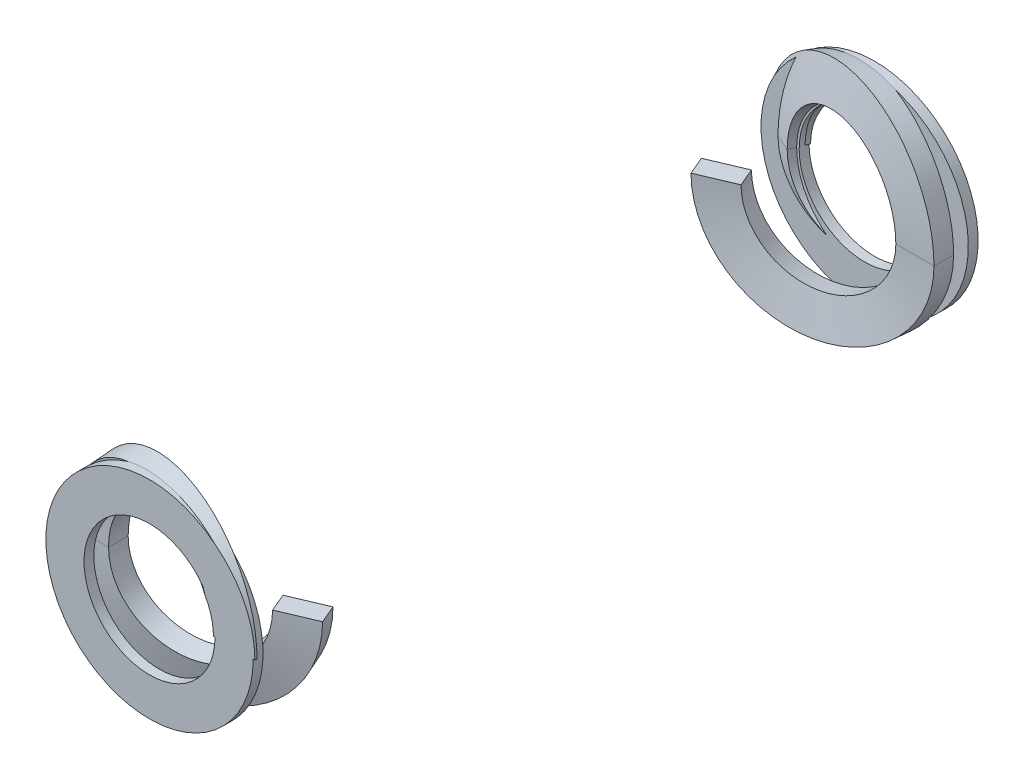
SolidWorks part; units mm, degrees
ref_plane "Front" through (0, 0, 0) normal (0, 0, 1) x (1, 0, 0)
ref_plane "Top" through (0, 0, 0) normal (0, 1, 0) x (1, 0, 0)
ref_plane "Right" through (0, 0, 0) normal (1, 0, 0) x (0, 0, -1)
sketch "Logo3_Revol_Axis" plane through (0, 0, 0) normal (0, 1, 0) x (1, 0, 0)
  line L0 (0, -30.1034) -> (0, 30.1034) construction
sketch "Logo3_bib0" plane through (0, 0, 0) normal (0, 1, 0) x (1, 0, 0)
  line L0 (-6.35, 0) -> (6.35, 0) construction
  line L1 (0, 0) -> (0, 41.91) construction
  dimension "logo3_d1" = 12.7
  dimension "logo3_l1" = 41.91
sketch "logo3_bib1" plane through (0, 0, 0) normal (0, 1, 0) x (1, 0, 0)
  line L0 (-6.35, 0) -> (6.35, 0) construction
  line L1 (6.35, 0) -> (6.35, 41.91) construction
  line L2 (6.35, 41.91) -> (-6.35, 41.91) construction
  line L3 (-6.35, 41.91) -> (-6.35, 0) construction
  line L4 (5.9927, 0) -> (5.9927, 41.91) construction
  line L5 (-5.9927, 42.4772) -> (-5.9927, 0) construction
  line L6 (3.7869, 0) -> (3.7869, 41.91) construction
  line L7 (-3.7869, 0) -> (-3.7869, 42.4772) construction
  line L8 (0, 0) -> (0, 41.91) construction
  line L9 (4.8898, 41.91) -> (4.8898, 0) construction
  line L10 (-4.8898, 41.91) -> (-4.8898, 0) construction
  line L11 (4.8898, 0) -> (-4.8898, 1.9853) construction
  line L12 (0, 0.9926) -> (0.5968, 3.9327) construction
  line L13 (-4.8898, 1.9853) -> (4.8898, 3.9706) construction
  line L14 (-4.8898, 41.91) -> (4.8898, 39.9247) construction
  line L15 (4.8898, 3.9706) -> (-4.8898, 5.9559) construction
  line L16 (0, 2.9779) -> (-0.5968, 5.918) construction
  line L17 (0, 4.9632) -> (0.5968, 7.9033) construction
  line L18 (0, 40.9174) -> (-0.5968, 37.9773) construction
  line L19 (-22.523, 45.8806) -> (29.4917, 45.8806) construction
  line L20 (-22.523, -7.9412) -> (25.6601, -7.9412) construction
  line L21 (4.8898, 39.9247) -> (-4.8898, 37.9394) construction
  line L22 (0, 38.9321) -> (0.5968, 35.992) construction
  line L23 (0, 0) -> (-0.5968, 2.94) construction
  line L24 (-5.9927, 42.4772) -> (-3.7869, 42.4772)
  line L25 (-5.9927, 42.4772) -> (-5.9927, 41.3428)
  line L26 (-5.9927, 41.3428) -> (-3.7869, 41.3428)
  line L27 (-3.7869, 42.4772) -> (-3.7869, 41.3428)
  line L28 (3.7869, -0.5672) -> (5.9927, -0.5672)
  line L29 (3.7869, -0.5672) -> (3.7869, 0.5672)
  line L30 (3.7869, 0.5672) -> (5.9927, 0.5672)
  line L31 (5.9927, -0.5672) -> (5.9927, 0.5672)
  line L32 (0, 41.91) -> (0.5968, 38.97) construction
  circle A1 centre (4.8898, 39.9247) radius 1.1029
  circle A2 centre (4.8898, 3.9706) radius 1.1029
  circle A4 centre (-4.8898, 1.9853) radius 1.1029
  circle A5 centre (-4.8898, 5.9559) radius 1.1029
  circle A6 centre (-4.8898, 37.9394) radius 1.1029
sketch "Sketch4" plane through (0, 0, 0) normal (0, 1, 0) x (1, 0, 0)
  line L0 (0, 0) -> (0, 41.91) construction
  line L1 (0, 0) -> (0, 41.91) construction
  line L2 (-5.9927, 42.4772) -> (-5.9927, 41.3428) construction
  line L3 (-5.9927, 41.3428) -> (-3.7869, 41.3428) construction
  line L4 (-3.7869, 42.4772) -> (-3.7869, 41.3428) construction
  line L5 (-5.9927, 42.4772) -> (-3.7869, 42.4772) construction
  line L6 (-5.9927, 42.4772) -> (-5.9927, 41.3428)
  line L7 (-5.9927, 41.3428) -> (-3.7869, 41.3428)
  line L8 (-3.7869, 42.4772) -> (-3.7869, 41.3428)
  line L9 (-5.9927, 42.4772) -> (-3.7869, 42.4772)
  line L10 (3.7869, -0.5672) -> (3.7869, 0.5672) construction
  line L11 (3.7869, 0.5672) -> (5.9927, 0.5672) construction
  line L12 (5.9927, -0.5672) -> (5.9927, 0.5672) construction
  line L13 (3.7869, -0.5672) -> (5.9927, -0.5672) construction
  line L14 (3.7869, -0.5672) -> (3.7869, 0.5672)
  line L15 (3.7869, 0.5672) -> (5.9927, 0.5672)
  line L16 (5.9927, -0.5672) -> (5.9927, 0.5672)
  line L17 (3.7869, -0.5672) -> (5.9927, -0.5672)
revolve "Revolve2" add sketch "Sketch4" angle 360 about L1
sketch "Sketch5" plane through (0, 0, 0) normal (0, -1, 0) x (1, 0, 0)
  line L0 (0, -0.9926) -> (0.5968, -3.9327) construction
  line L1 (0, -0.9926) -> (0.5968, -3.9327) construction
  line L2 (-5.9927, -42.4772) -> (-5.9927, 0) construction
  line L3 (-3.7869, 0) -> (-3.7869, -42.4772) construction
  line L7 (-5.9927, -1.4181) -> (-3.7869, -1.4181)
  line L8 (-5.9927, -1.4181) -> (-5.9927, -2.5525)
  line L9 (-5.9927, -2.5525) -> (-3.7869, -2.5525)
  line L10 (-3.7869, -1.4181) -> (-3.7869, -2.5525)
revolve "Revolve3" add sketch "Sketch5" angle 180 about L1
sketch "Sketch6" plane through (0, 0, 0) normal (0, 1, 0) x (1, 0, 0)
  line L0 (0, 2.9779) -> (-0.5968, 5.918) construction
  line L1 (0, 2.9779) -> (-0.5968, 5.918) construction
  line L6 (-3.7869, 2.5525) -> (-3.7869, 1.4181) construction
  line L7 (-5.9927, 2.5525) -> (-3.7869, 2.5525) construction
  line L8 (-5.9927, 1.4181) -> (-5.9927, 2.5525) construction
  line L9 (-3.7869, 1.4181) -> (-5.9927, 1.4181) construction
  line L10 (-3.7869, 2.5525) -> (-3.7869, 1.4181)
  line L11 (-5.9927, 2.5525) -> (-3.7869, 2.5525)
  line L12 (-5.9927, 1.4181) -> (-5.9927, 2.5525)
  line L13 (-3.7869, 1.4181) -> (-5.9927, 1.4181)
revolve "Revolve4" add sketch "Sketch6" angle 180 about L1
sketch "Sketch11" plane through (0, 0, 0) normal (0, 1, 0) x (1, 0, 0)
  line L0 (3.653, -0.0922) -> (5.6843, -0.9524) construction
  line L1 (4.7747, -0.5672) -> (5.6843, -0.9524)
  line L3 (5.6843, -0.9524) -> (6.1266, 0.0922) construction
  line L4 (0, 0) -> (-0.5968, 2.94) construction
  line L5 (0, 0) -> (-0.5968, 2.94) construction
  line L7 (5.6843, -0.9524) -> (5.8474, -0.5672)
  line L8 (3.7869, -0.5672) -> (5.9927, -0.5672) construction
  line L10 (4.7747, -0.5672) -> (5.8474, -0.5672)
revolve "Revolve8" add sketch "Sketch11" angle 90 about L5
sketch "Sketch8" plane through (0, 0, 0) normal (0, 1, 0) x (1, 0, 0)
  line L0 (0, 40.9174) -> (-0.5968, 37.9773) construction
  line L1 (0, 40.9174) -> (-0.5968, 37.9773) construction
  line L2 (5.9927, 0) -> (5.9927, 41.91) construction
  line L3 (3.7869, 0) -> (3.7869, 41.91) construction
  line L11 (5.9927, 40.4919) -> (3.7869, 40.4919)
  line L12 (5.9927, 40.4919) -> (5.9927, 39.3575)
  line L13 (5.9927, 39.3575) -> (3.7869, 39.3575)
  line L14 (3.7869, 40.4919) -> (3.7869, 39.3575)
revolve "Revolve6" add sketch "Sketch8" angle 180 about L1
sketch "Sketch10" plane through (0, 0, 0) normal (0, 1, 0) x (1, 0, 0)
  line L0 (0, 38.9321) -> (0.5968, 35.992) construction
  line L1 (0, 38.9321) -> (0.5968, 35.992) construction
  line L11 (5.9927, 39.3575) -> (5.9927, 40.4919)
  line L12 (3.7869, 39.3575) -> (5.9927, 39.3575)
  line L13 (3.7869, 40.4919) -> (3.7869, 39.3575)
  line L14 (5.9927, 40.4919) -> (3.7869, 40.4919)
  line L15 (5.9927, 39.3575) -> (5.9927, 40.4919)
  line L16 (3.7869, 39.3575) -> (5.9927, 39.3575)
  line L17 (3.7869, 40.4919) -> (3.7869, 39.3575)
  line L18 (5.9927, 40.4919) -> (3.7869, 40.4919)
  dimension "D1" = 0
revolve "Revolve7" add sketch "Sketch10" angle 180 about L1
sketch "Sketch13" plane through (0, 0, 0) normal (0, 1, 0) x (1, 0, 0)
  line L0 (-3.653, 42.0022) -> (-4.0954, 40.9576) construction
  line L1 (-4.0954, 40.9576) -> (-6.1266, 41.8178) construction
  line L2 (-3.9322, 41.3428) -> (-4.0954, 40.9576)
  line L3 (-4.0954, 40.9576) -> (-5.005, 41.3428)
  line L4 (-5.9927, 41.3428) -> (-3.7869, 41.3428) construction
  line L5 (-5.005, 41.3428) -> (-3.9322, 41.3428)
  line L6 (0, 41.91) -> (0.5968, 38.97) construction
  line L7 (0, 41.91) -> (0.5968, 38.97) construction
revolve "Revolve9" add sketch "Sketch13" angle 90 about L7
sketch "Sketch9" plane through (0, 0, 0) normal (0, 1, 0) x (1, 0, 0)
  line L0 (6.35, 0) -> (6.35, 41.91) construction
  line L1 (-6.35, 0) -> (6.35, 0)
  line L2 (-6.35, 0) -> (-6.35, -7.9412)
  line L3 (-6.35, -7.9412) -> (6.35, -7.9412)
  line L4 (6.35, 0) -> (6.35, -7.9412)
  line L5 (-6.35, 41.91) -> (-6.35, 0) construction
  line L6 (6.35, 41.91) -> (-6.35, 41.91)
  line L7 (6.35, 41.91) -> (6.35, 45.8806)
  line L8 (6.35, 45.8806) -> (-6.35, 45.8806)
  line L9 (-6.35, 41.91) -> (-6.35, 45.8806)
  line L10 (-22.523, -7.9412) -> (25.6601, -7.9412) construction
  line L11 (-22.523, 45.8806) -> (29.4917, 45.8806) construction
extrude "Cut-Extrude1" cut sketch "Sketch9" against normal through all and the other way through all
sketch "Sketch14" plane through (0, 0, 0) normal (0, 1, 0) x (1, 0, 0)
  line L0 (4.8898, 41.91) -> (4.8898, 0) construction
  line L1 (-4.8898, 41.91) -> (-4.8898, 0) construction
  line L2 (4.8898, 41.91) -> (4.8898, 0) construction
  line L3 (-4.8898, 41.91) -> (-4.8898, 0) construction
equation "\"Ray1@logo3_bib1\" = \"Logo3_d2*1.06/2@logo3_bib1\""
equation "\"Ray2@logo3_bib1\" = \"Logo3_(d1-(.1*d2))/2@logo3_bib1\""
equation "\"Ray3@logo3_bib1\" = (\"Ray1@logo3_bib1\"+\"Ray2@logo3_bib1\")/2"
equation "\"Ray3bis@logo3_bib1\" = \"Ray3@logo3_bib1\""
equation "\"Dist1@logo3_bib1\" = (\"Logo3_(d1-(.1*d2))/2@logo3_bib1\"-\"Logo3_d2*1.06/2@logo3_bib1\")*.9"
equation "\"Dist2@logo3_bib1\" = \"Dist1@logo3_bib1\"*2"
equation "\"Dist3@logo3_bib1\" = \"Dist1@logo3_bib1\"*3"
equation "\"Dist1bis@logo3_bib1\" = \"Dist1@logo3_bib1\""
equation "\"Dist4@logo3_bib1\" = \"Dist1@logo3_bib1\"*2"
equation "\"Dist5@logo3_bib1\" = \"Dist4@logo3_bib1\"*2"
equation "\"Dist2bis@logo3_bib1\" = \"Dist2@logo3_bib1\""
equation "\"EpBrin@logo3_bib1\" = \"Dist1bis@logo3_bib1\"/3.5"
equation "\"EpBrin_1@logo3_bib1\" = \"EpBrin@logo3_bib1\""
equation "\"EpBrin_2@logo3_bib1\" = \"EpBrin@logo3_bib1\""
equation "\"EpBrin_3@logo3_bib1\" = \"EpBrin@logo3_bib1\""
equation "\"EpBrin_1@Sketch5\" = \"EpBrin@logo3_bib1\""
equation "\"EpBrin_2@Sketch5\" = \"EpBrin@logo3_bib1\""
equation "\"EpBrin_1@Sketch8\" = \"EpBrin@logo3_bib1\""
equation "\"EpBrin_2@Sketch8\" = \"EpBrin@logo3_bib1\""
